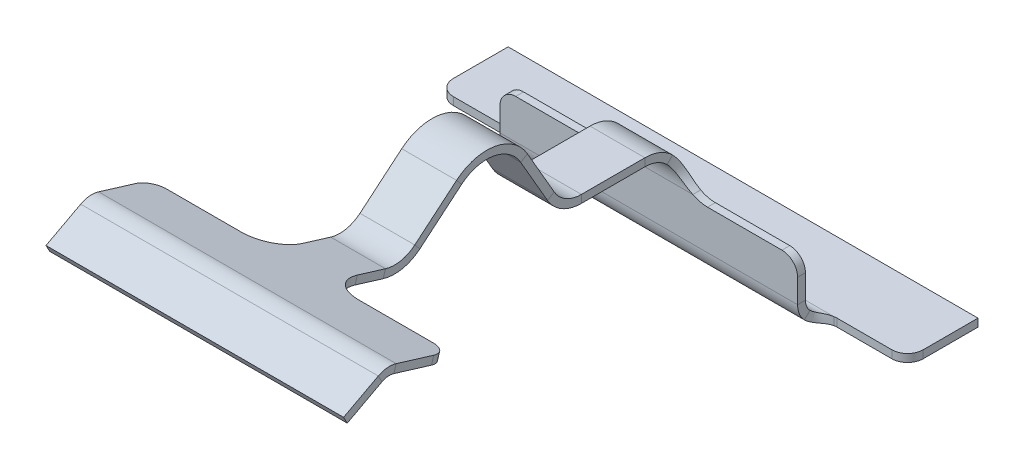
SolidWorks part; units mm, degrees
ref_plane "Face" through (0, 0, 0) normal (0, 0, 1) x (1, 0, 0)
ref_plane "Dessus" through (0, 0, 0) normal (0, 1, 0) x (1, 0, 0)
ref_plane "Droite" through (0, 0, 0) normal (1, 0, 0) x (0, 0, -1)
sketch "Esquisse3" plane through (0, 0, 0) normal (0, 0, 1) x (1, 0, 0)
  line L0 (10.5, 4.5) -> (14, 4.5)
  line L1 (-15, 0) -> (15, 0)
  line L2 (-15, 0) -> (-15, 3.5)
  line L3 (-14, 4.5) -> (-10.5, 4.5)
  line L4 (15, 0) -> (15, 3.5)
  line L5 (3.75, 9) -> (8.5, 9)
  line L6 (-9.5, 5.5) -> (-9.5, 8)
  line L7 (-8.5, 9) -> (-3.75, 9)
  line L8 (9.5, 5.5) -> (9.5, 8)
  line L9 (3.75, 37) -> (8.5, 37)
  line L10 (-1.75, 11) -> (-1.75, 35)
  line L12 (1.75, 11) -> (1.75, 35)
  line L13 (-9.5, 44) -> (9.5, 44)
  line L14 (-9.5, 44) -> (-9.5, 38)
  line L15 (-8.5, 37) -> (-3.75, 37)
  line L16 (9.5, 44) -> (9.5, 38)
  arc A0 (1.75, 35) -> (3.75, 37) centre (3.75, 35) cw
  arc A1 (-3.75, 37) -> (-1.75, 35) centre (-3.75, 35) cw
  arc A2 (-1.75, 11) -> (-3.75, 9) centre (-3.75, 11) cw
  arc A3 (1.75, 11) -> (3.75, 9) centre (3.75, 11) ccw
  arc A4 (9.5, 8) -> (8.5, 9) centre (8.5, 8) ccw
  arc A5 (9.5, 5.5) -> (10.5, 4.5) centre (10.5, 5.5) ccw
  arc A6 (-9.5, 5.5) -> (-10.5, 4.5) centre (-10.5, 5.5) cw
  arc A7 (-8.5, 9) -> (-9.5, 8) centre (-8.5, 8) ccw
  arc A8 (9.5, 38) -> (8.5, 37) centre (8.5, 38) cw
  arc A9 (-8.5, 37) -> (-9.5, 38) centre (-8.5, 38) cw
  arc A10 (15, 3.5) -> (14, 4.5) centre (14, 3.5) ccw
  arc A11 (-14, 4.5) -> (-15, 3.5) centre (-14, 3.5) ccw
  point P4 (0, 0)
  point P20 (0, 44)
  point P23 (-1.75, 37)
  point P26 (-1.75, 9)
  point P31 (9.5, 9)
  point P34 (9.5, 4.5)
  point P41 (9.5, 37)
  point P46 (15, 4.5)
  dimension "D11" = 2
  dimension "D12" = 1
  dimension "D1" = 4.5
  dimension "D2" = 30
  dimension "D3" = 19
  dimension "D4" = 4.5
  dimension "D5" = 3.5
  dimension "D6" = 28
  dimension "D7" = 7
  dimension "D8" = 19
  dimension "D9" = 9.5
  dimension "D10" = 1.75
extrude "Base-Extrusion" add sketch "Esquisse3" along normal blind 0.5
sheet metal parameters "Tôlerie 2" parameters "D1"=1, "Epaisseur"=0.5
flatten bends "Dépliage 12" parameters "D1"=0
sketch "Esquisse-Angle12" plane through (0, 0, 0) normal (0, 0, -1) x (-1, 0, 0)
process bends "Pliage 12" parameters "D1"=0
sketch "Esquisse-Plate12" plane through (0, 0, 0) normal (0, 0, -1) x (-1, 0, 0)
  line L0 (-9.5, 5.5) -> (9.5, 5.5)
  line L1 (-1.9664, 11) -> (1.75, 11)
  line L2 (-1.75, 18) -> (1.75, 18)
  line L3 (-1.75, 11) -> (-1.75, 35) construction
  line L4 (1.75, 35) -> (1.75, 11) construction
  line L5 (15, 0) -> (-15, 0) construction
  line L6 (-1.75, 25) -> (1.75, 25)
  line L7 (-1.75, 32) -> (1.75, 32)
  line L9 (-9.5, 41) -> (9.5, 41)
  line L10 (-9.5, 38) -> (-9.5, 44) construction
  line L11 (9.5, 44) -> (9.5, 38) construction
  line L12 (-9.5, 44) -> (9.5, 44) construction
  point P5 (0, 9.3)
  dimension "D1" = 18
  dimension "D2" = 25
  dimension "D3" = 12
bend "Pli défini à plat6" bend angle 90 parameters "D1"=0, "D5"=1
bend "Pli défini à plat7" bend radius 2 bend angle 90 parameters "D5"=2
bend "Pli défini à plat8" bend radius 2 bend angle 60 parameters "D5"=3
bend "Pli défini à plat9" bend radius 2.5 bend angle 100 parameters "D5"=4
bend "Pli défini à plat10" bend radius 2 bend angle 57 parameters "D5"=5
bend "Pli défini à plat11" bend radius 1 bend angle 45 parameters "D5"=6
